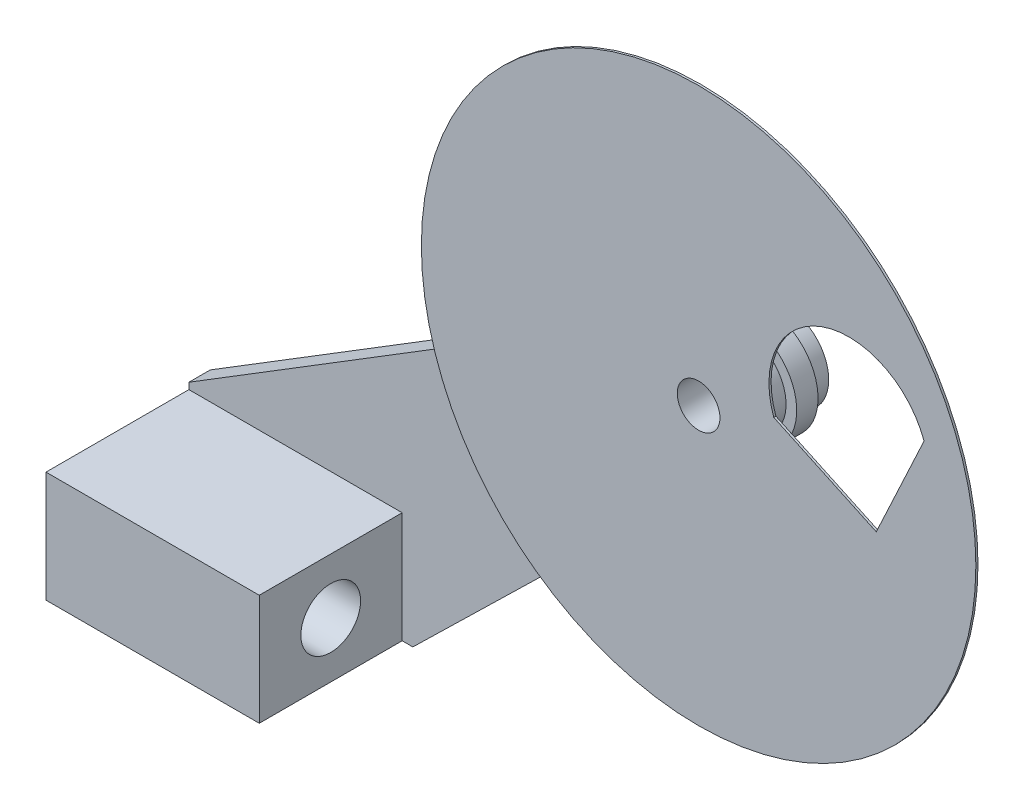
SolidWorks part; units mm, degrees
ref_plane "Plan 1" through (0, 0, 0) normal (0, 0, 1) x (1, 0, 0)
ref_plane "Plan 2" through (0, 0, 0) normal (0, 1, 0) x (1, 0, 0)
ref_plane "Plan 3" through (0, 0, 0) normal (1, 0, 0) x (0, 0, -1)
sketch "Esquisse1" plane through (0, 0, 0) normal (0, 0, 1) x (1, 0, 0)
  line L0 (-109, -148) -> (241, -148)
  line L1 (-109, -148) -> (-109, 92)
  line L2 (241, -148) -> (241, 92)
  line L3 (-109, 92) -> (241, 92)
  dimension "D1" = 350
  dimension "D2" = 240
extrude "Base-Extrusion" add sketch "Esquisse1" along normal blind 10
sketch "Esquisse2" plane through (0, 0, 10) normal (0, 0, 1) x (1, 0, 0)
  line L1 (-109, -148) -> (-9, -148)
  line L2 (-109, -148) -> (-109, -96)
  line L3 (-109, -96) -> (-9, -96)
  line L4 (-9, -148) -> (-9, -96)
  dimension "D1" = 52
  dimension "D2" = 100
extrude "Boss.-Extru.1" add sketch "Esquisse2" along normal blind 67
sketch "Esquisse3" plane through (-9, 0, 0) normal (1, 0, 0) x (0, 0, -1)
  line L0 (-10, -96) -> (-77, -148) construction
  circle A0 centre (-43.5, -122) radius 14
  dimension "D1" = 28
extrude "Enlèv. mat.-Extru.1" cut sketch "Esquisse3" against normal through all
sketch "Esquisse4" plane through (0, 0, 10) normal (0, 0, 1) x (1, 0, 0)
  line L2 (-81, -122) -> (229.8664, -122) construction
  line L3 (-109, -122) -> (-9, -122) construction
  line L4 (-9, -148) -> (-9, -96) construction
  circle A0 centre (151, 38) radius 20
  dimension "D1" = 40
  dimension "D2" = 160
  dimension "D3" = 160
extrude "Boss.-Extru.2" add sketch "Esquisse4" along normal blind 20 and the other way blind 20
sketch "Esquisse10" plane through (0, 0, 10) normal (0, 0, 1) x (1, 0, 0)
  line L0 (-109, -93) -> (137.8754, 59.2778)
  line L2 (-4, -148) -> (168.4503, 20.0979)
  line L3 (-9, -148) -> (241, -148) construction
  line L4 (-109, -93) -> (-109, 92)
  line L5 (-109, 92) -> (241, 92)
  line L7 (241, 92) -> (241, -148)
  line L8 (241, -148) -> (-4, -148)
  line L9 (241, -148) -> (241, 92) construction
  arc A0 (168.4503, 20.0979) -> (137.8754, 59.2778) centre (151, 38) ccw
  dimension "D1" = 50
  dimension "D2" = 245
  dimension "D3" = 185
extrude "Enlèv. mat.-Extru.5" cut sketch "Esquisse10" against normal through all
sketch "Esquisse6" plane through (0, 0, 30) normal (0, 0, 1) x (1, 0, 0)
  circle A0 centre (151, 38) radius 130
  dimension "D1" = 260
extrude "Boss.-Extru.3" add sketch "Esquisse6" along normal blind 1
sketch "Esquisse8" plane through (0, 0, 31) normal (0, 0, 1) x (1, 0, 0)
  circle A0 centre (151, 38) radius 10
  dimension "D1" = 20
extrude "Enlèv. mat.-Extru.3" cut sketch "Esquisse8" against normal through all
sketch "Esquisse9" plane through (0, 0, 31) normal (0, 0, 1) x (1, 0, 0)
  line L0 (151, 38) -> (151, -42.3639) construction
  line L1 (151, 38) -> (151, 158.6361) construction
  line L2 (151, 38) -> (332.2275, 103.9614) construction
  line L3 (221.4769, 63.6515) -> (263.6396, -52.1895) construction
  line L4 (256.7154, 76.4773) -> (234.3027, 28.413)
  line L5 (234.3027, 28.413) -> (186.2385, 50.8258)
  circle A0 centre (151, 38) radius 75 construction
  arc A1 (256.7154, 76.4773) -> (186.2385, 50.8258) centre (221.4769, 63.6515) ccw
  circle A2 centre (151, 38) radius 130 construction
  dimension "D1" = 150
  dimension "D3" = 37.5
  dimension "D2" = 250
extrude "Enlèv. mat.-Extru.4" cut sketch "Esquisse9" against normal up to next
sketch "Esq_WRNL_Compact001" plane through (0, 0, 0) normal (0, 0, 1) x (1, 0, 0)
  line L0 (-110.0001, -149) -> (-110.0001, 169)
  line L1 (282, -149) -> (282, 169)
  line L2 (-110.0001, -149) -> (282, -149)
  line L3 (-110.0001, 169) -> (282, 169)
